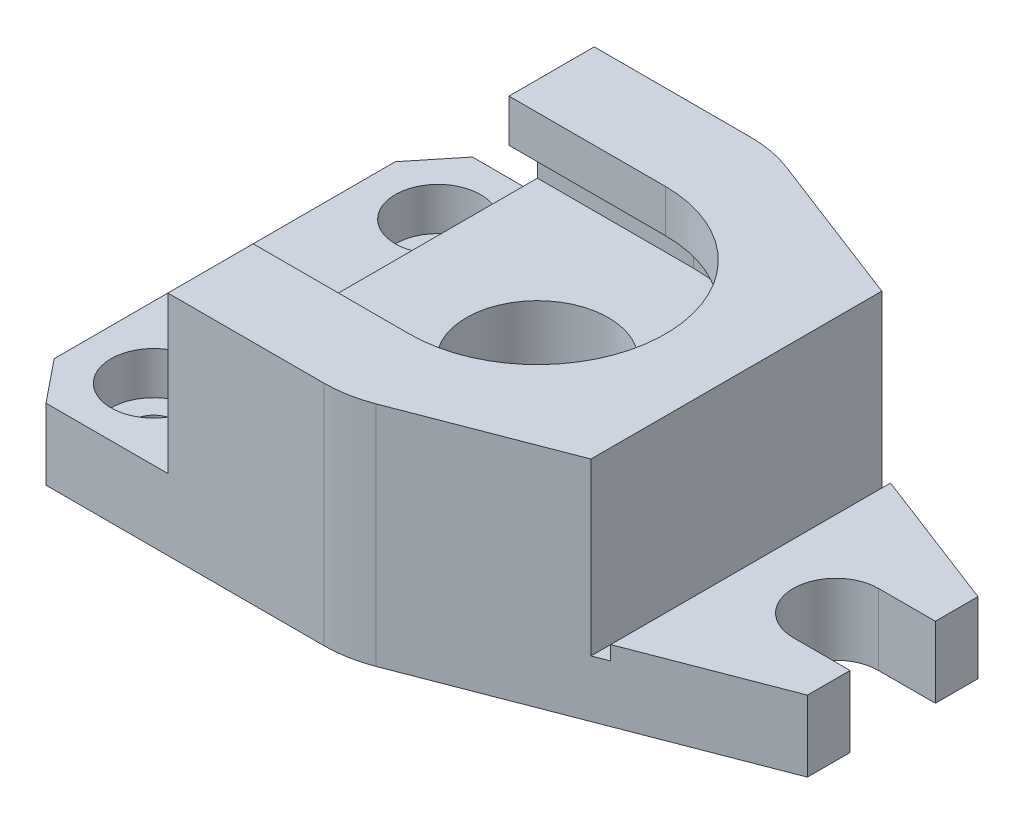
SolidWorks part; units mm, degrees
ref_plane "前视基准面" through (0, 0, 0) normal (0, 0, 1) x (1, 0, 0)
ref_plane "上视基准面" through (0, 0, 0) normal (0, 1, 0) x (1, 0, 0)
ref_plane "右视基准面" through (0, 0, 0) normal (1, 0, 0) x (0, 0, -1)
sketch "草图2" plane through (0, 0, 0) normal (0, 1, 0) x (1, 0, 0)
  line L0 (0, 0) -> (125.6497, 0) construction
  line L1 (125.6497, 0) -> (0, 0) construction
  line L2 (0, 0) -> (0, 103.1693) construction
  line L3 (-22, -12) -> (-22, 12)
  line L4 (-22, 12) -> (-19.5748, 15)
  line L5 (-19.5748, 15) -> (0, 15)
  line L6 (21, 3) -> (25, 3)
  line L7 (25, 3) -> (25, 6)
  line L8 (25, 6) -> (3.087, 14.4269)
  line L9 (25, -6) -> (3.087, -14.4269)
  line L10 (25, -3) -> (25, -6)
  line L11 (21, -3) -> (25, -3)
  line L12 (-19.5748, -15) -> (0, -15)
  line L13 (-22, -12) -> (-19.5748, -15)
  arc A0 (21, 3) -> (21, -3) centre (21, 0) ccw
  arc A1 (0, 15) -> (3.087, 14.4269) centre (0, 6.3997) cw
  arc A2 (0, -15) -> (3.087, -14.4269) centre (0, -6.3997) ccw
  point P22 (-22, 0)
extrude "拉伸1" add sketch "草图2" along normal blind 5
sketch "草图5" plane through (0, 5, 0) normal (0, 1, 0) x (1, 0, 0)
  line L0 (14, 10.2302) -> (14, -10.2302)
  line L1 (25, 6) -> (3.087, 14.4269) construction
  line L2 (3.087, -14.4269) -> (25, -6) construction
  line L3 (25, 3) -> (25, 6) construction
  line L4 (-11, 15) -> (-11, 11)
  line L5 (0, 15) -> (-19.5748, 15) construction
  line L6 (-19.5748, -15) -> (0, -15) construction
  line L7 (-22, 12) -> (-22, -12) construction
  line L8 (-11, 15) -> (0, 15)
  line L9 (-11, -15) -> (0, -15)
  line L10 (3.087, -14.4269) -> (14, -10.2302)
  line L11 (3.087, 14.4269) -> (14, 10.2302)
  line L12 (-11, 11) -> (-11, -11)
  line L14 (-11, -11) -> (-11, -15)
  arc A0 (0, 15) -> (3.087, 14.4269) centre (0, 6.3997) cw
  arc A1 (0, -15) -> (3.087, -14.4269) centre (0, -6.3997) ccw
  point P6 (25, 4.5)
  dimension "D1" = 11
  dimension "D2" = 11
extrude "拉伸2" add sketch "草图5" along normal blind 5
sketch "草图7" plane through (0, 10, 0) normal (0, 1, 0) x (1, 0, 0)
  line L0 (0, 11) -> (-11, 11)
  line L1 (-11, 15) -> (-11, -15) construction
  line L2 (0, -11) -> (-11, -11)
  line L3 (-11, 15) -> (-11, -15) construction
  line L4 (-11, -11) -> (-11, -15)
  line L5 (-11, -15) -> (0, -15)
  line L6 (-11, 11) -> (-11, 15)
  line L7 (-11, 15) -> (0, 15)
  line L8 (3.087, 14.4269) -> (14, 10.2302)
  line L9 (14, 10.2302) -> (14, -10.2302)
  line L10 (14, -10.2302) -> (3.087, -14.4269)
  arc A0 (0, -11) -> (0, 11) centre (0, 0) ccw
  arc A1 (0, 15) -> (3.087, 14.4269) centre (0, 6.3997) cw
  arc A2 (0, -15) -> (3.087, -14.4269) centre (0, -6.3997) ccw
extrude "拉伸3" add sketch "草图7" along normal blind 3
sketch "草图8" plane through (0, 13, 0) normal (0, 1, 0) x (1, 0, 0)
  line L0 (0, 9) -> (-11, 9)
  line L1 (-11, 15) -> (-11, -15) construction
  line L2 (-11, 9) -> (-11, 15)
  line L3 (-11, 15) -> (0, 15)
  line L4 (0, -9) -> (-11, -9)
  line L5 (-11, -9) -> (-11, -15)
  line L6 (-11, -15) -> (0, -15)
  line L7 (-11, -15) -> (0, -15) construction
  line L8 (3.087, 14.4269) -> (14, 10.2302)
  line L9 (14, 10.2302) -> (14, -10.2302)
  line L10 (14, -10.2302) -> (3.087, -14.4269)
  line L11 (3.087, -14.4269) -> (14, -10.2302) construction
  arc A0 (0, -9) -> (0, 9) centre (0, 0) ccw
  arc A1 (0, -15) -> (3.087, -14.4269) centre (0, -6.3997) ccw construction
  arc A2 (0, 15) -> (3.087, 14.4269) centre (0, 6.3997) cw
  arc A3 (0, -15) -> (3.087, -14.4269) centre (0, -6.3997) ccw
extrude "拉伸4" add sketch "草图8" along normal blind 3
sketch "草图9" plane through (0, 10, 0) normal (0, 1, 0) x (1, 0, 0)
  circle A0 centre (0, 0) radius 5
extrude "切除-拉伸1" cut sketch "草图9" against normal through all
sketch "草图10" plane through (0, 5, 0) normal (0, 1, 0) x (1, 0, 0)
  line L0 (-11, 15) -> (-19.5748, 15) construction
  line L1 (-22, 12) -> (-22, -12) construction
  line L2 (0, 0) -> (-24.0109, 0) construction
  circle A0 centre (-17, 10) radius 1.5
  circle A1 centre (-17, -10) radius 1.5
  dimension "D1" = 5
  dimension "D2" = 5
extrude "切除-拉伸2" cut sketch "草图10" against normal through all
sketch "草图11" plane through (0, 5, 0) normal (0, 1, 0) x (1, 0, 0)
  line L0 (0, 0) -> (-23.4291, 0) construction
  circle A0 centre (-17, 10) radius 3
  circle A1 centre (-17, -10) radius 3
extrude "切除-拉伸3" cut sketch "草图11" against normal blind 3
sketch "草图13" plane through (0, 5, 0) normal (0, 1, 0) x (1, 0, 0)
  line L0 (14, 10.2302) -> (14, -10.2302)
  line L1 (14, -10.2302) -> (15, -9.8456)
  line L2 (14, -10.2302) -> (25, -6) construction
  line L3 (15, -9.8456) -> (15, 9.8456)
  line L4 (25, 6) -> (14, 10.2302) construction
  line L5 (15, 9.8456) -> (14, 10.2302)
  dimension "D1" = 1
extrude "切除-拉伸4" cut sketch "草图13" against normal blind 1
